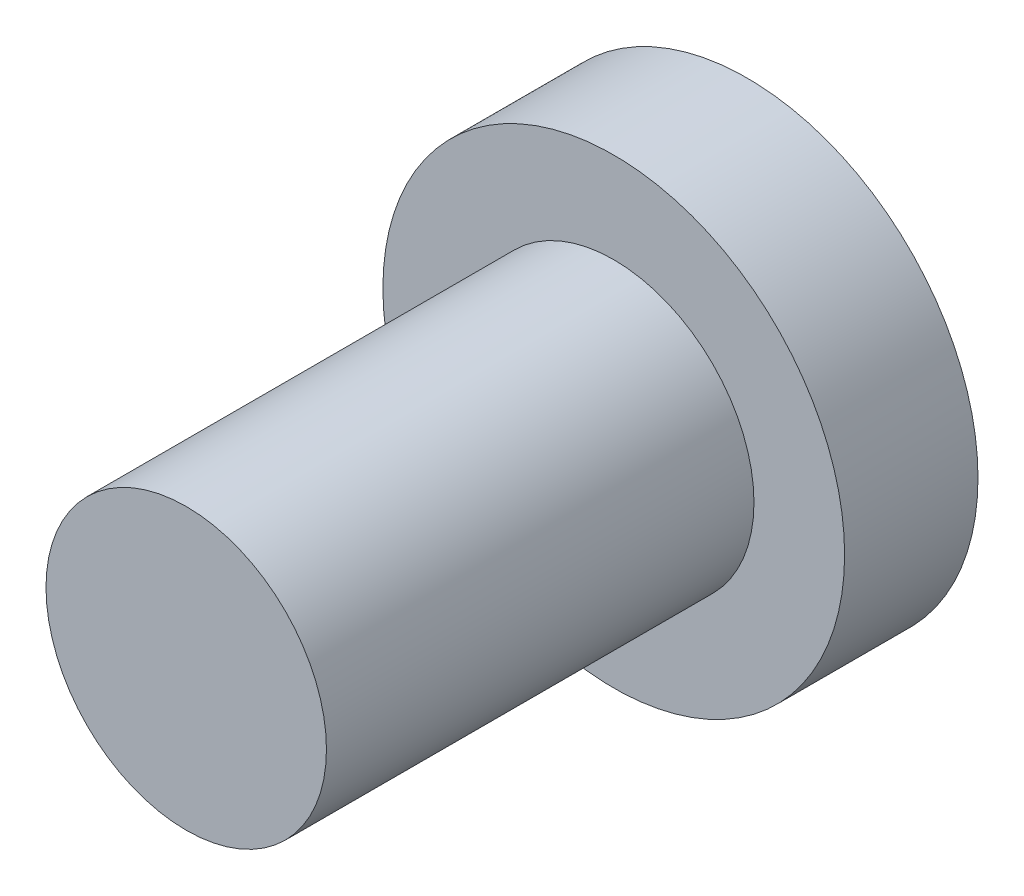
SolidWorks part; units mm, degrees
ref_plane "Front Plane" through (0, 0, 0) normal (0, 0, 1) x (1, 0, 0)
ref_plane "Top Plane" through (0, 0, 0) normal (0, 1, 0) x (1, 0, 0)
ref_plane "Right Plane" through (0, 0, 0) normal (1, 0, 0) x (0, 0, -1)
sketch "Sketch6" plane through (0, 0, 0) normal (1, 0, 0) x (0, 0, -1)
  line L0 (-6.35, 0) -> (22.525, 0) construction
  line L1 (3.7719, 0) -> (-3.7719, 0) construction
  line L2 (-6.35, 0) -> (-6.35, -2.0828)
  line L3 (-6.35, -2.0828) -> (0, -2.0828)
  line L4 (0, 3.7719) -> (0, -3.7719) construction
  line L5 (0, -2.0828) -> (0, -3.429)
  line L6 (0, -3.429) -> (1.9812, -3.429)
  line L7 (1.9812, -3.429) -> (1.9812, 0)
  line L8 (1.9812, 0) -> (-6.35, 0)
  dimension "L" = 6.35
  dimension "H" = 1.9812
  dimension "A" = 6.858
  dimension "D" = 4.1656
revolve "Revolve1" add sketch "Sketch6" angle 360 about L0
sketch "Sketch7" plane through (0, 0, -1.9812) normal (0, 0, -1) x (-1, 0, 0)
  line L2 (-0.9906, 0.5719) -> (-0.9906, -0.5719)
  line L4 (-0.9906, -0.5719) -> (0, -1.1438)
  line L5 (0, -1.1438) -> (0.9906, -0.5719)
  line L6 (0.9906, -0.5719) -> (0.9906, 0.5719)
  line L7 (0.9906, 0.5719) -> (0, 1.1438)
  line L8 (0, 1.1438) -> (-0.9906, 0.5719)
  circle A0 centre (0, 0) radius 0.9906 construction
  dimension "J" = 1.9812
extrude "HEX" cut sketch "Sketch7" against normal blind 1.524
